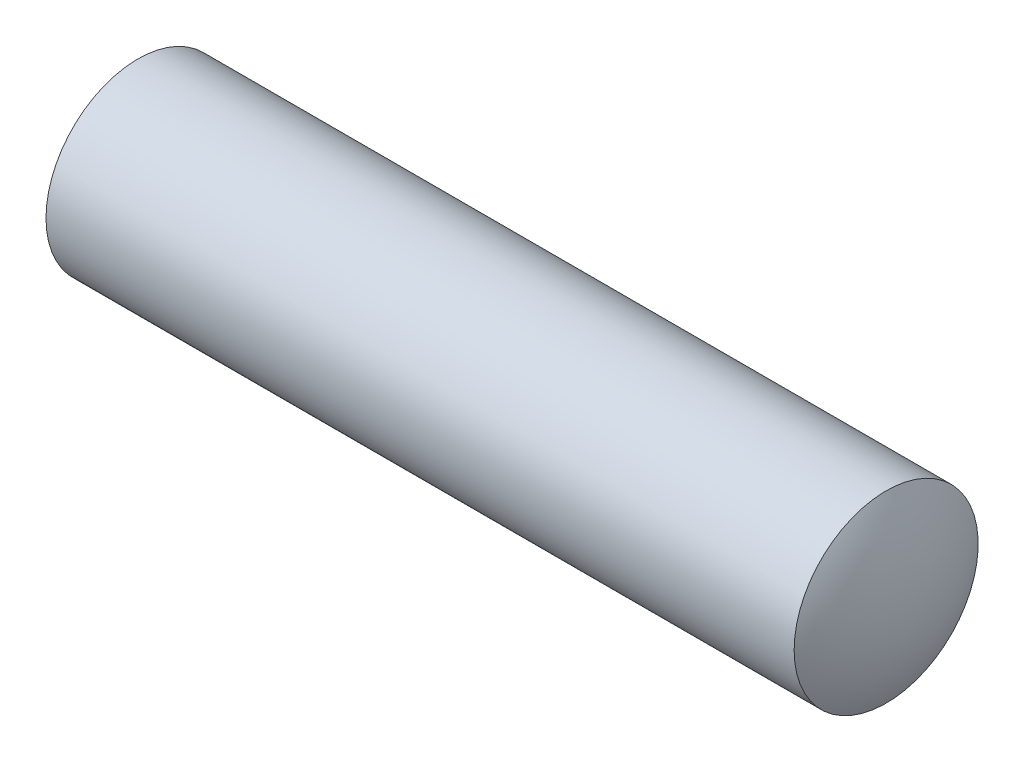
SolidWorks part; units mm, degrees
ref_plane "Plane1" through (0, 0, 0) normal (0, 0, 1) x (1, 0, 0)
ref_plane "Plane2" through (0, 0, 0) normal (0, 1, 0) x (1, 0, 0)
ref_plane "Plane3" through (0, 0, 0) normal (1, 0, 0) x (0, 0, -1)
sketch "Esquisse1" plane through (0, 0, 0) normal (0, 0, 1) x (1, 0, 0)
  line L0 (0, 0) -> (35.5, 0) construction
  line L1 (0.8038, 3) -> (25.1962, 3)
  line L2 (0, 0) -> (26, 0)
  arc A1 (26, 0) -> (25.1962, 3) centre (20, 0) ccw
  arc A3 (0.8038, 3) -> (0, 0) centre (6, 0) ccw
  dimension "D2" = 6
  dimension "D3" = 6
  dimension "D1" = 3
  dimension "D4" = 14
revolve "Base-Révolution" add sketch "Esquisse1" angle 360 about L0
